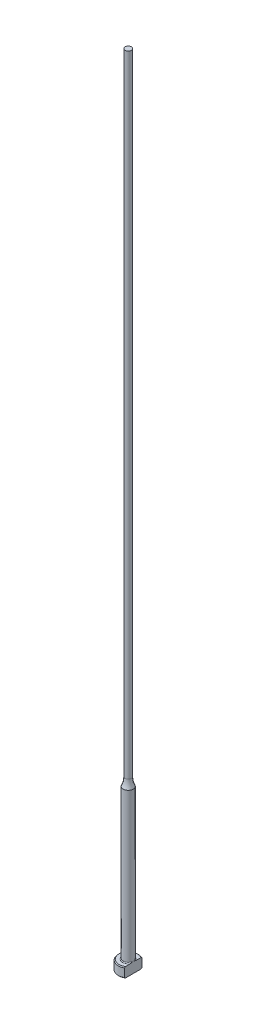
SolidWorks part; units mm, degrees
ref_plane "Front Plane" through (0, 0, 0) normal (0, 0, 1) x (1, 0, 0)
ref_plane "Top Plane" through (0, 0, 0) normal (0, 1, 0) x (1, 0, 0)
ref_plane "Right Plane" through (0, 0, 0) normal (1, 0, 0) x (0, 0, -1)
sketch "Sketch1" plane through (0, 0, 0) normal (0, 0, 1) x (1, 0, 0)
  line L0 (0, 259.9588) -> (0, -15.1925) construction
  line L1 (0, 0) -> (-3.175, 0)
  line L2 (-3.175, 0) -> (-3.175, 3.175)
  line L3 (-3.175, 3.175) -> (-1.5875, 3.175)
  line L4 (-0.9919, 53.4851) -> (-0.9919, 254)
  line L5 (-0.9919, 254) -> (0, 254)
  line L6 (0, 254) -> (0, 0)
  line L7 (-1.5875, 3.175) -> (-1.5875, 50.8)
  arc A0 (-1.5875, 50.8) -> (-0.9919, 53.4851) centre (-7.3419, 53.4851) ccw
  point P13 (-1.5875, 0)
  dimension "D1" = 6.35
  dimension "L" = 254
  dimension "D2" = 3.175
  dimension "H" = 6.35
  dimension "T" = 3.175
  dimension "D" = 1.9837
  dimension "S" = 50.8
revolve "Revolve1" add sketch "Sketch1" angle 360 about L0
chamfer "Chamfer1" distance 0.254 angle 45 2 edges at (0, 3.175, 3.175) (0, 0, 3.175)
fillet "Fillet1" radius 0.254 1 edges at (0, 3.175, 1.5875)
sketch "Sketch2" plane through (0, 0, 0) normal (0, 1, 0) x (1, 0, 0)
  line L0 (1.5875, -2.7496) -> (1.5875, 2.7496)
  circle A0 centre (0, 0) radius 3.175 construction
  arc A2 (1.5875, -2.7496) -> (1.5875, 2.7496) centre (0, 0) ccw
  circle A3 centre (0, 0) radius 3.175 construction
  circle A4 centre (0, 0) radius 1.5875 construction
extrude "Key Head" cut sketch "Sketch2" along normal up to next
